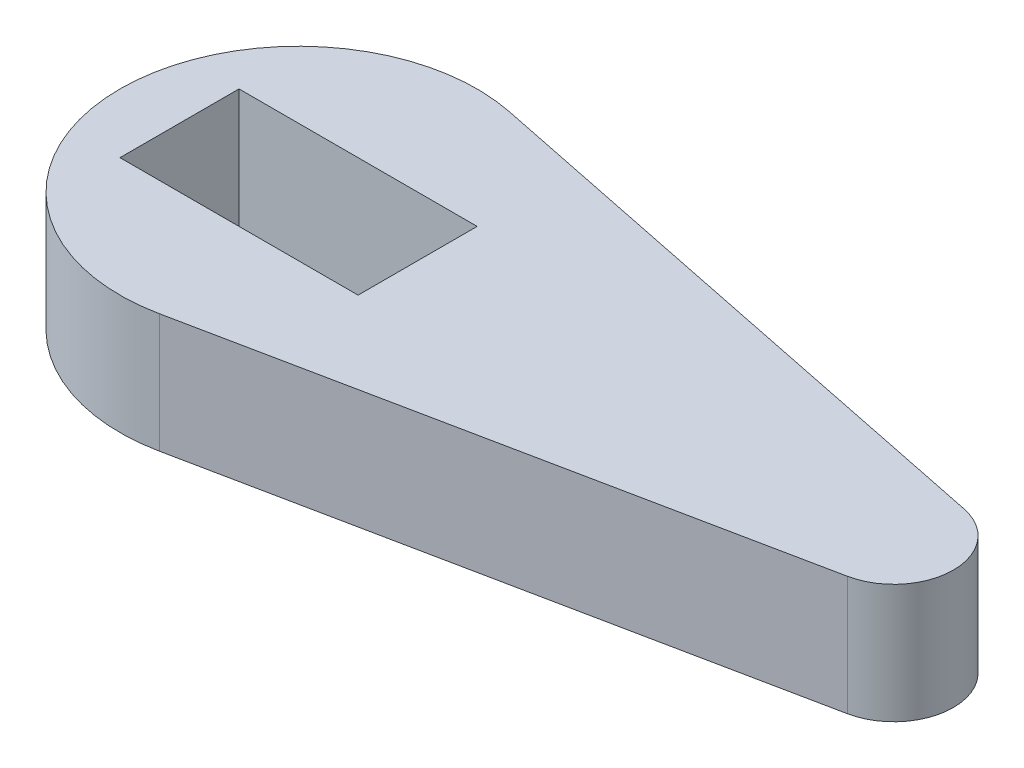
SolidWorks part; units mm, degrees
ref_plane "Front" through (0, 0, 0) normal (0, 0, 1) x (1, 0, 0)
ref_plane "Top" through (0, 0, 0) normal (0, 1, 0) x (1, 0, 0)
ref_plane "Right" through (0, 0, 0) normal (1, 0, 0) x (0, 0, -1)
sketch "Sketch1" plane through (0, 0, 0) normal (0, 1, 0) x (1, 0, 0)
  line L0 (0, 0) -> (33.0347, 0) construction
  line L1 (0.9525, 4.6663) -> (16.1925, 1.5554)
  line L2 (0.9525, -4.6663) -> (16.1925, -1.5554)
  arc A0 (16.1925, 1.5554) -> (16.1925, -1.5554) centre (15.875, 0) cw
  arc A1 (0.9525, 4.6663) -> (0.9525, -4.6663) centre (0, 0) ccw
  point P9 (33.0347, 0)
  dimension "D1" = 4.7625
  dimension "D2" = 1.5875
  dimension "D3" = 15.875
extrude "Base-Extrude" add sketch "Sketch1" along normal blind 3.175
sketch "Sketch2" plane through (0, 3.175, 0) normal (0, 1, 0) x (-1, 0, 0)
  line L0 (0, 0) -> (-8.7843, 0) construction
  line L1 (0, 0) -> (0, -7.3534) construction
  line L2 (-3.175, 1.5875) -> (-3.175, -1.5875)
  line L3 (3.175, 1.5875) -> (3.175, -1.5875)
  line L4 (3.175, 1.5875) -> (-3.175, 1.5875)
  line L5 (3.175, -1.5875) -> (-3.175, -1.5875)
  dimension "D1" = 6.35
  dimension "D2" = 3.175
  dimension "D3" = 3.175
  dimension "D4" = 1.5875
extrude "Cut-Extrude1" cut sketch "Sketch2" against normal through all
